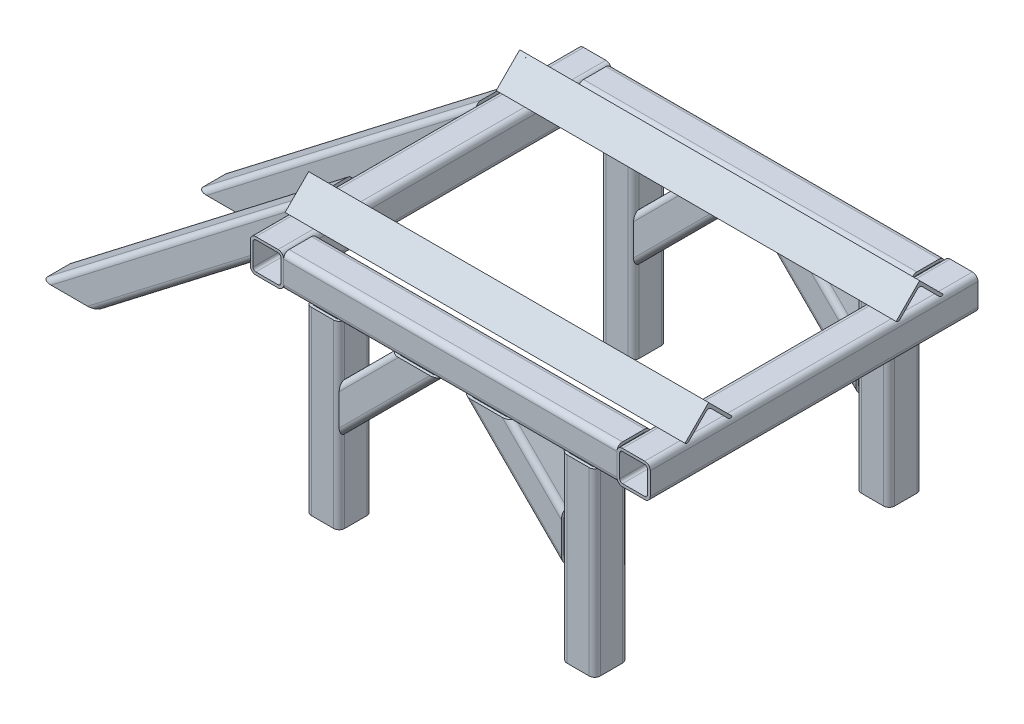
SolidWorks part; units mm, degrees
ref_plane "Front" through (0, 0, 0) normal (0, 0, 1) x (1, 0, 0)
ref_plane "Top" through (0, 0, 0) normal (0, 1, 0) x (1, 0, 0)
ref_plane "Right" through (0, 0, 0) normal (1, 0, 0) x (0, 0, -1)
ref_plane "Top of Frame" through (0, 508, 0) normal (0, 1, 0) x (-1, 0, 0)
ref_plane "Bottom of Legs" through (0, 19.05, 0) normal (0, 1, 0) x (-1, 0, 0)
sketch "Upper Frame" plane through (0, 508, 0) normal (0, 1, 0) x (-1, 0, 0)
  line L0 (-457.2, 374.65) -> (457.2, -374.65) construction
  line L1 (-457.2, -374.65) -> (457.2, -374.65)
  line L2 (-457.2, -374.65) -> (-457.2, 374.65)
  line L3 (-457.2, 374.65) -> (457.2, 374.65)
  line L4 (457.2, -374.65) -> (457.2, 374.65)
  dimension "D1" = 914.4
  dimension "D2" = 749.3
ref_plane "Front of Frame" through (0, 0, 374.65) normal (0, 0, 1) x (1, 0, 0)
sketch "Leg Sketch" plane through (0, 0, 374.65) normal (0, 0, 1) x (1, 0, 0)
  line L0 (0, 0) -> (0, 430.7934) construction
  line L1 (-292.1, 19.05) -> (-292.1, 508)
  line L2 (457.2, 508) -> (-457.2, 508) construction
  line L3 (292.1, 222.25) -> (6.35, 508)
  line L4 (-292.1, 222.25) -> (-6.35, 508)
  line L5 (50, 19.05) -> (-50, 19.05) construction
  line L6 (457.2, 508) -> (-457.2, 508) construction
  line L7 (292.1, 19.05) -> (292.1, 508)
  dimension "D1" = 584.2
  dimension "D2" = 203.2
  dimension "D3" = 45
ref_plane "Back of Plane" through (0, 0, -374.65) normal (0, 0, 1) x (1, 0, 0)
sketch "Sketch137" plane through (0, 0, -374.65) normal (0, 0, 1) x (1, 0, 0)
  line L0 (0, 0) -> (0, 430.7934) construction
  line L1 (-292.1, 19.05) -> (-292.1, 508)
  line L3 (292.1, 222.25) -> (6.35, 508)
  line L4 (-292.1, 222.25) -> (-6.35, 508)
  line L7 (292.1, 19.05) -> (292.1, 508)
  dimension "D1" = 584.2
  dimension "D2" = 203.2
  dimension "D3" = 45
other "Structural Member1"
ref_plane "Plane1" through (457.2, 508, -374.65) normal (0, 0, 1) x (1, 0, 0)
sketch "Sketch1" plane through (419.1, 469.9, -374.65) normal (0, 0, 1) x (1, 0, 0)
  line L0 (-25.4, -31.75) -> (25.4, -31.75)
  line L1 (-31.75, -25.4) -> (-31.75, 25.4)
  line L2 (25.4, 31.75) -> (-25.4, 31.75)
  line L3 (31.75, 25.4) -> (31.75, -25.4)
  line L4 (-25.4, -38.1) -> (25.4, -38.1)
  line L5 (-38.1, -25.4) -> (-38.1, 25.4)
  line L6 (25.4, 38.1) -> (-25.4, 38.1)
  line L7 (38.1, 25.4) -> (38.1, -25.4)
  line L8 (0, 0) -> (31.75, 0) construction
  line L9 (0, 0) -> (0, 31.75) construction
  arc A0 (38.1, 25.4) -> (25.4, 38.1) centre (25.4, 25.4) ccw
  arc A1 (25.4, -38.1) -> (38.1, -25.4) centre (25.4, -25.4) ccw
  arc A2 (-38.1, -25.4) -> (-25.4, -38.1) centre (-25.4, -25.4) ccw
  arc A3 (-25.4, 38.1) -> (-38.1, 25.4) centre (-25.4, 25.4) ccw
  arc A4 (-25.4, 31.75) -> (-31.75, 25.4) centre (-25.4, 25.4) ccw
  arc A5 (31.75, 25.4) -> (25.4, 31.75) centre (25.4, 25.4) ccw
  arc A6 (25.4, -31.75) -> (31.75, -25.4) centre (25.4, -25.4) ccw
  arc A7 (-31.75, -25.4) -> (-25.4, -31.75) centre (-25.4, -25.4) ccw
  point P3 (0, 38.1)
  point P4 (38.1, 0)
  point P5 (0, -38.1)
  point P6 (-38.1, 0)
  point P7 (-38.1, 38.1)
  point P8 (-38.1, -38.1)
  point P33 (0, 0)
  point P35 (38.1, -38.1)
  point P36 (38.1, 38.1)
  point P37 (0, 0)
  dimension "D1" = 12.7
  dimension "Thickness" = 6.35
  dimension "V_leg" = 76.2
other "Structural Member2"
ref_plane "Plane2" through (292.1, 19.05, 374.65) normal (0, 1, 0) x (-1, 0, 0)
sketch "Sketch11" plane through (292.1, 19.05, 336.55) normal (0, 1, 0) x (-1, 0, 0)
  line L0 (-25.4, -31.75) -> (25.4, -31.75)
  line L1 (-31.75, -25.4) -> (-31.75, 25.4)
  line L2 (25.4, 31.75) -> (-25.4, 31.75)
  line L3 (31.75, 25.4) -> (31.75, -25.4)
  line L4 (-25.4, -38.1) -> (25.4, -38.1)
  line L5 (-38.1, -25.4) -> (-38.1, 25.4)
  line L6 (25.4, 38.1) -> (-25.4, 38.1)
  line L7 (38.1, 25.4) -> (38.1, -25.4)
  line L8 (0, 0) -> (31.75, 0) construction
  line L9 (0, 0) -> (0, 31.75) construction
  arc A0 (38.1, 25.4) -> (25.4, 38.1) centre (25.4, 25.4) ccw
  arc A1 (25.4, -38.1) -> (38.1, -25.4) centre (25.4, -25.4) ccw
  arc A2 (-38.1, -25.4) -> (-25.4, -38.1) centre (-25.4, -25.4) ccw
  arc A3 (-25.4, 38.1) -> (-38.1, 25.4) centre (-25.4, 25.4) ccw
  arc A4 (-25.4, 31.75) -> (-31.75, 25.4) centre (-25.4, 25.4) ccw
  arc A5 (31.75, 25.4) -> (25.4, 31.75) centre (25.4, 25.4) ccw
  arc A6 (25.4, -31.75) -> (31.75, -25.4) centre (25.4, -25.4) ccw
  arc A7 (-31.75, -25.4) -> (-25.4, -31.75) centre (-25.4, -25.4) ccw
  point P3 (0, 38.1)
  point P4 (38.1, 0)
  point P5 (0, -38.1)
  point P6 (-38.1, 0)
  point P7 (-38.1, 38.1)
  point P8 (-38.1, -38.1)
  point P33 (0, 0)
  point P35 (38.1, -38.1)
  point P36 (38.1, 38.1)
  point P37 (0, 0)
  dimension "D1" = 12.7
  dimension "Thickness" = 6.35
  dimension "V_leg" = 76.2
other "Trim/Extend1"
other "End cap1" [suppressed] parameters "D1"=6.35, "D2"=3.175, "D3"=6.35
mirror "Mirror1" [suppressed] about plane through (0, 0, 0) normal (1, 0, 0)
mirror "Mirror2" [suppressed] about plane through (0, 0, 0) normal (0, 0, 1)
other "Structural Member4"
ref_plane "Plane5" through (-292.1, 19.05, 374.65) normal (0, 1, 0) x (-1, 0, 0)
sketch "Sketch135" plane through (-292.1, 19.05, 336.55) normal (0, 1, 0) x (-1, 0, 0)
  line L0 (-25.4, -31.75) -> (25.4, -31.75)
  line L1 (-31.75, -25.4) -> (-31.75, 25.4)
  line L2 (25.4, 31.75) -> (-25.4, 31.75)
  line L3 (31.75, 25.4) -> (31.75, -25.4)
  line L4 (-25.4, -38.1) -> (25.4, -38.1)
  line L5 (-38.1, -25.4) -> (-38.1, 25.4)
  line L6 (25.4, 38.1) -> (-25.4, 38.1)
  line L7 (38.1, 25.4) -> (38.1, -25.4)
  line L8 (0, 0) -> (31.75, 0) construction
  line L9 (0, 0) -> (0, 31.75) construction
  arc A0 (38.1, 25.4) -> (25.4, 38.1) centre (25.4, 25.4) ccw
  arc A1 (25.4, -38.1) -> (38.1, -25.4) centre (25.4, -25.4) ccw
  arc A2 (-38.1, -25.4) -> (-25.4, -38.1) centre (-25.4, -25.4) ccw
  arc A3 (-25.4, 38.1) -> (-38.1, 25.4) centre (-25.4, 25.4) ccw
  arc A4 (-25.4, 31.75) -> (-31.75, 25.4) centre (-25.4, 25.4) ccw
  arc A5 (31.75, 25.4) -> (25.4, 31.75) centre (25.4, 25.4) ccw
  arc A6 (25.4, -31.75) -> (31.75, -25.4) centre (25.4, -25.4) ccw
  arc A7 (-31.75, -25.4) -> (-25.4, -31.75) centre (-25.4, -25.4) ccw
  point P3 (0, 38.1)
  point P4 (38.1, 0)
  point P5 (0, -38.1)
  point P6 (-38.1, 0)
  point P7 (-38.1, 38.1)
  point P8 (-38.1, -38.1)
  point P33 (0, 0)
  point P35 (38.1, -38.1)
  point P36 (38.1, 38.1)
  point P37 (0, 0)
  dimension "D1" = 12.7
  dimension "Thickness" = 6.35
  dimension "V_leg" = 76.2
other "Trim/Extend2"
sketch "Sketch16" plane through (0, 508, 0) normal (0, 1, 0) x (-1, 0, 0)
  line L0 (-201.9552, 0) -> (136.2023, 0) construction
  line L1 (-457.2, 241.3) -> (457.2, 241.3)
  line L2 (-457.2, 374.65) -> (-457.2, -374.65) construction
  line L3 (457.2, -374.65) -> (457.2, 374.65) construction
  line L4 (-457.2, -241.3) -> (457.2, -241.3)
  dimension "D1" = 482.6
other "Structural Member3"
ref_plane "Plane3" through (457.2, 508, 241.3) normal (-1, 0, 0) x (0, 0, 1)
sketch "Sketch131" plane through (457.2, 563.7435, 241.3) normal (-1, 0, 0) x (0, -0.7071, -0.7071)
  line L0 (0, 0) -> (0, 76.2)
  line L1 (0, 76.2) -> (0.0051, 76.2)
  line L2 (6.35, 69.8551) -> (6.35, 14.2875)
  line L3 (14.2875, 6.35) -> (69.8551, 6.35)
  line L4 (76.2, 0.0051) -> (76.2, 0)
  line L5 (76.2, 0) -> (0, 0)
  line L6 (4.4916, 74.3416) -> (74.3416, 4.4916) construction
  arc A0 (76.2, 0.0051) -> (69.8551, 6.35) centre (69.8551, 0.0051) ccw
  arc A1 (0.0051, 76.2) -> (6.35, 69.8551) centre (0.0051, 69.8551) cw
  arc A2 (14.2875, 6.35) -> (6.35, 14.2875) centre (14.2875, 14.2875) cw
  point P10 (38.1, 0)
  point P14 (0, 38.1)
  point P15 (6.35, 38.1)
  point P16 (38.1, 6.35)
  point P17 (6.35, 76.2)
  point P18 (76.2, 6.35)
  point P21 (39.4166, 39.4166)
  point P22 (0, 0)
  dimension "D2" = 0.0051
  dimension "D3" = 76.2
  dimension "Radius_1" = 7.9375
  dimension "D1" = 6.35
  dimension "H_leg" = 76.2
other "Structural Member5"
ref_plane "Plane7" through (292.1, 19.05, -374.65) normal (0, 1, 0) x (-1, 0, 0)
sketch "Sketch136" plane through (292.1, 19.05, -336.55) normal (0, 1, 0) x (-1, 0, 0)
  line L0 (-25.4, -31.75) -> (25.4, -31.75)
  line L1 (-31.75, -25.4) -> (-31.75, 25.4)
  line L2 (25.4, 31.75) -> (-25.4, 31.75)
  line L3 (31.75, 25.4) -> (31.75, -25.4)
  line L4 (-25.4, -38.1) -> (25.4, -38.1)
  line L5 (-38.1, -25.4) -> (-38.1, 25.4)
  line L6 (25.4, 38.1) -> (-25.4, 38.1)
  line L7 (38.1, 25.4) -> (38.1, -25.4)
  line L8 (0, 0) -> (31.75, 0) construction
  line L9 (0, 0) -> (0, 31.75) construction
  arc A0 (38.1, 25.4) -> (25.4, 38.1) centre (25.4, 25.4) ccw
  arc A1 (25.4, -38.1) -> (38.1, -25.4) centre (25.4, -25.4) ccw
  arc A2 (-38.1, -25.4) -> (-25.4, -38.1) centre (-25.4, -25.4) ccw
  arc A3 (-25.4, 38.1) -> (-38.1, 25.4) centre (-25.4, 25.4) ccw
  arc A4 (-25.4, 31.75) -> (-31.75, 25.4) centre (-25.4, 25.4) ccw
  arc A5 (31.75, 25.4) -> (25.4, 31.75) centre (25.4, 25.4) ccw
  arc A6 (25.4, -31.75) -> (31.75, -25.4) centre (25.4, -25.4) ccw
  arc A7 (-31.75, -25.4) -> (-25.4, -31.75) centre (-25.4, -25.4) ccw
  point P3 (0, 38.1)
  point P4 (38.1, 0)
  point P5 (0, -38.1)
  point P6 (-38.1, 0)
  point P7 (-38.1, 38.1)
  point P8 (-38.1, -38.1)
  point P33 (0, 0)
  point P35 (38.1, -38.1)
  point P36 (38.1, 38.1)
  point P37 (0, 0)
  dimension "D1" = 12.7
  dimension "Thickness" = 6.35
  dimension "V_leg" = 76.2
other "Trim/Extend3"
other "Structural Member6"
ref_plane "Plane8" through (-292.1, 19.05, -374.65) normal (0, 1, 0) x (-1, 0, 0)
sketch "Sketch138" plane through (-292.1, 19.05, -336.55) normal (0, 1, 0) x (-1, 0, 0)
  line L0 (-25.4, -31.75) -> (25.4, -31.75)
  line L1 (-31.75, -25.4) -> (-31.75, 25.4)
  line L2 (25.4, 31.75) -> (-25.4, 31.75)
  line L3 (31.75, 25.4) -> (31.75, -25.4)
  line L4 (-25.4, -38.1) -> (25.4, -38.1)
  line L5 (-38.1, -25.4) -> (-38.1, 25.4)
  line L6 (25.4, 38.1) -> (-25.4, 38.1)
  line L7 (38.1, 25.4) -> (38.1, -25.4)
  line L8 (0, 0) -> (31.75, 0) construction
  line L9 (0, 0) -> (0, 31.75) construction
  arc A0 (38.1, 25.4) -> (25.4, 38.1) centre (25.4, 25.4) ccw
  arc A1 (25.4, -38.1) -> (38.1, -25.4) centre (25.4, -25.4) ccw
  arc A2 (-38.1, -25.4) -> (-25.4, -38.1) centre (-25.4, -25.4) ccw
  arc A3 (-25.4, 38.1) -> (-38.1, 25.4) centre (-25.4, 25.4) ccw
  arc A4 (-25.4, 31.75) -> (-31.75, 25.4) centre (-25.4, 25.4) ccw
  arc A5 (31.75, 25.4) -> (25.4, 31.75) centre (25.4, 25.4) ccw
  arc A6 (25.4, -31.75) -> (31.75, -25.4) centre (25.4, -25.4) ccw
  arc A7 (-31.75, -25.4) -> (-25.4, -31.75) centre (-25.4, -25.4) ccw
  point P3 (0, 38.1)
  point P4 (38.1, 0)
  point P5 (0, -38.1)
  point P6 (-38.1, 0)
  point P7 (-38.1, 38.1)
  point P8 (-38.1, -38.1)
  point P33 (0, 0)
  point P35 (38.1, -38.1)
  point P36 (38.1, 38.1)
  point P37 (0, 0)
  dimension "D1" = 12.7
  dimension "Thickness" = 6.35
  dimension "V_leg" = 76.2
other "Trim/Extend4"
ref_plane "Plane9" through (0, 0, -177.8) normal (0, 0, 1) x (1, 0, 0)
sketch "Sketch139" plane through (0, 0, -177.8) normal (0, 0, 1) x (1, 0, 0)
  line L0 (-457.2, 508) -> (-1092.2, 19.05)
  line L2 (50, 19.05) -> (-50, 19.05) construction
  dimension "D1" = 635
ref_plane "Plane10" through (0, 0, 177.8) normal (0, 0, 1) x (1, 0, 0)
sketch "Sketch140" plane through (0, 0, 177.8) normal (0, 0, 1) x (1, 0, 0)
  line L1 (-457.2, 508) -> (-1092.2, 19.05)
  line L3 (50, 19.05) -> (-50, 19.05) construction
  dimension "D1" = 635
other "Structural Member7"
ref_plane "Plane11" through (-457.2, 508, -177.8) normal (-0.7923, -0.6101, 0) x (0, 0, 1)
sketch "Sketch141" plane through (-433.9554, 477.8123, -177.8) normal (-0.7923, -0.6101, 0) x (0, 0, 1)
  line L0 (-25.4, -31.75) -> (25.4, -31.75)
  line L1 (-31.75, -25.4) -> (-31.75, 25.4)
  line L2 (25.4, 31.75) -> (-25.4, 31.75)
  line L3 (31.75, 25.4) -> (31.75, -25.4)
  line L4 (-25.4, -38.1) -> (25.4, -38.1)
  line L5 (-38.1, -25.4) -> (-38.1, 25.4)
  line L6 (25.4, 38.1) -> (-25.4, 38.1)
  line L7 (38.1, 25.4) -> (38.1, -25.4)
  line L8 (0, 0) -> (31.75, 0) construction
  line L9 (0, 0) -> (0, 31.75) construction
  arc A0 (38.1, 25.4) -> (25.4, 38.1) centre (25.4, 25.4) ccw
  arc A1 (25.4, -38.1) -> (38.1, -25.4) centre (25.4, -25.4) ccw
  arc A2 (-38.1, -25.4) -> (-25.4, -38.1) centre (-25.4, -25.4) ccw
  arc A3 (-25.4, 38.1) -> (-38.1, 25.4) centre (-25.4, 25.4) ccw
  arc A4 (-25.4, 31.75) -> (-31.75, 25.4) centre (-25.4, 25.4) ccw
  arc A5 (31.75, 25.4) -> (25.4, 31.75) centre (25.4, 25.4) ccw
  arc A6 (25.4, -31.75) -> (31.75, -25.4) centre (25.4, -25.4) ccw
  arc A7 (-31.75, -25.4) -> (-25.4, -31.75) centre (-25.4, -25.4) ccw
  point P3 (0, 38.1)
  point P4 (38.1, 0)
  point P5 (0, -38.1)
  point P6 (-38.1, 0)
  point P7 (-38.1, 38.1)
  point P8 (-38.1, -38.1)
  point P33 (0, 0)
  point P35 (38.1, -38.1)
  point P36 (38.1, 38.1)
  point P37 (0, 0)
  dimension "D1" = 12.7
  dimension "Thickness" = 6.35
  dimension "V_leg" = 76.2
other "Trim/Extend6"
other "Trim/Extend8"
other "Structural Member8"
ref_plane "Plane12" through (-457.2, 508, 177.8) normal (-0.7923, -0.6101, 0) x (0, 0, 1)
sketch "Sketch142" plane through (-433.9554, 477.8123, 177.8) normal (-0.7923, -0.6101, 0) x (0, 0, 1)
  line L0 (-25.4, -31.75) -> (25.4, -31.75)
  line L1 (-31.75, -25.4) -> (-31.75, 25.4)
  line L2 (25.4, 31.75) -> (-25.4, 31.75)
  line L3 (31.75, 25.4) -> (31.75, -25.4)
  line L4 (-25.4, -38.1) -> (25.4, -38.1)
  line L5 (-38.1, -25.4) -> (-38.1, 25.4)
  line L6 (25.4, 38.1) -> (-25.4, 38.1)
  line L7 (38.1, 25.4) -> (38.1, -25.4)
  line L8 (0, 0) -> (31.75, 0) construction
  line L9 (0, 0) -> (0, 31.75) construction
  arc A0 (38.1, 25.4) -> (25.4, 38.1) centre (25.4, 25.4) ccw
  arc A1 (25.4, -38.1) -> (38.1, -25.4) centre (25.4, -25.4) ccw
  arc A2 (-38.1, -25.4) -> (-25.4, -38.1) centre (-25.4, -25.4) ccw
  arc A3 (-25.4, 38.1) -> (-38.1, 25.4) centre (-25.4, 25.4) ccw
  arc A4 (-25.4, 31.75) -> (-31.75, 25.4) centre (-25.4, 25.4) ccw
  arc A5 (31.75, 25.4) -> (25.4, 31.75) centre (25.4, 25.4) ccw
  arc A6 (25.4, -31.75) -> (31.75, -25.4) centre (25.4, -25.4) ccw
  arc A7 (-31.75, -25.4) -> (-25.4, -31.75) centre (-25.4, -25.4) ccw
  point P3 (0, 38.1)
  point P4 (38.1, 0)
  point P5 (0, -38.1)
  point P6 (-38.1, 0)
  point P7 (-38.1, 38.1)
  point P8 (-38.1, -38.1)
  point P33 (0, 0)
  point P35 (38.1, -38.1)
  point P36 (38.1, 38.1)
  point P37 (0, 0)
  dimension "D1" = 12.7
  dimension "Thickness" = 6.35
  dimension "V_leg" = 76.2
other "Trim/Extend10"
other "Trim/Extend11"
other "Trim/Extend7"
other "Trim/Extend9"
sketch "Sketch145" plane through (0, 0, 0) normal (0, 0, 1) x (1, 0, 0)
  line L1 (516.9183, 641.2907) -> (-1156.8319, 641.2907)
  line L2 (516.9183, 641.2907) -> (516.9183, -84.6358)
  line L3 (516.9183, -84.6358) -> (-1156.8319, -84.6358)
  line L4 (-1156.8319, 641.2907) -> (-1156.8319, -84.6358)
extrude "Cut-Extrude1" [suppressed] cut sketch "Sketch145" along normal through all
